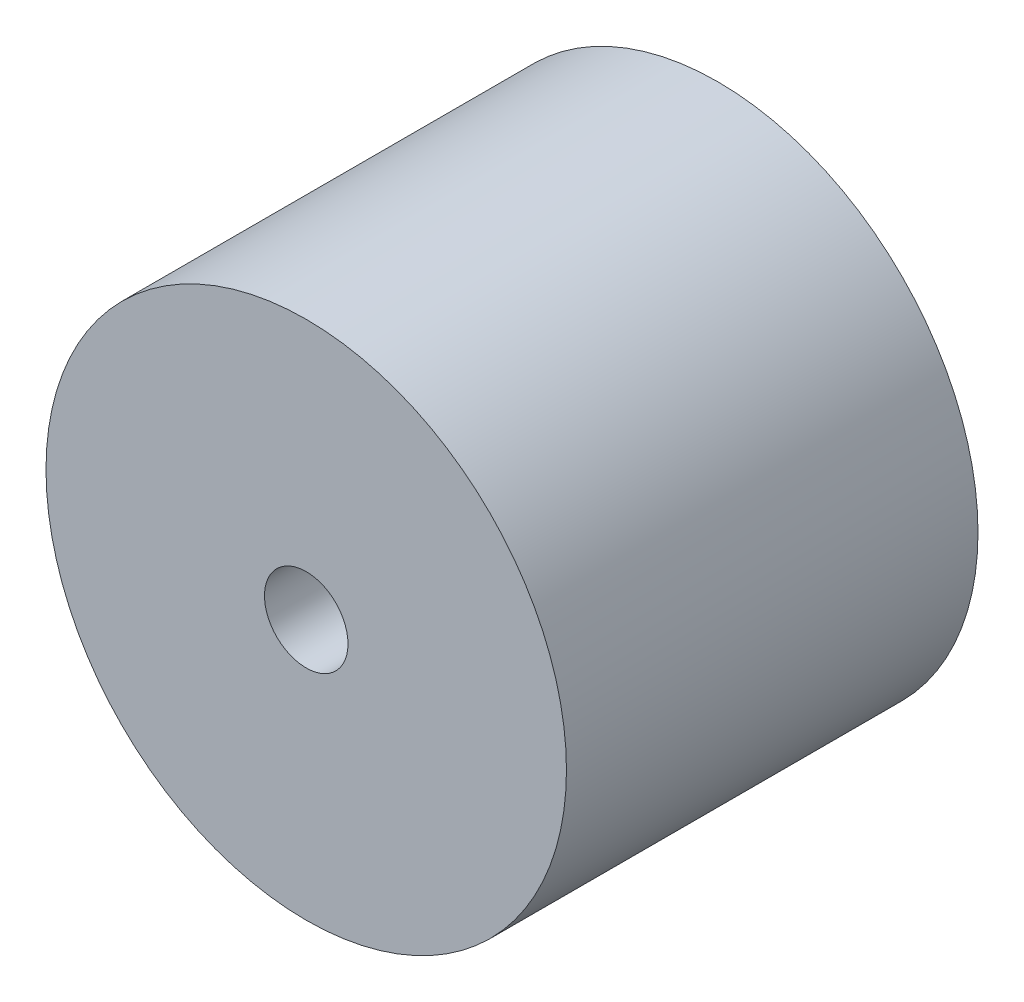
SolidWorks part; units mm, degrees
ref_plane "Face" through (0, 0, 0) normal (0, 0, 1) x (1, 0, 0)
ref_plane "Dessus" through (0, 0, 0) normal (0, 1, 0) x (1, 0, 0)
ref_plane "Droite" through (0, 0, 0) normal (1, 0, 0) x (0, 0, -1)
sketch "Esquisse1" plane through (0, 0, 0) normal (0, 0, 1) x (1, 0, 0)
  circle A0 centre (0, 0) radius 6.9
  circle A1 centre (0, 0) radius 43
  dimension "D1" = 13.8
  dimension "D2" = 86
extrude "Boss.-Extru.1" add sketch "Esquisse1" along normal blind 68
